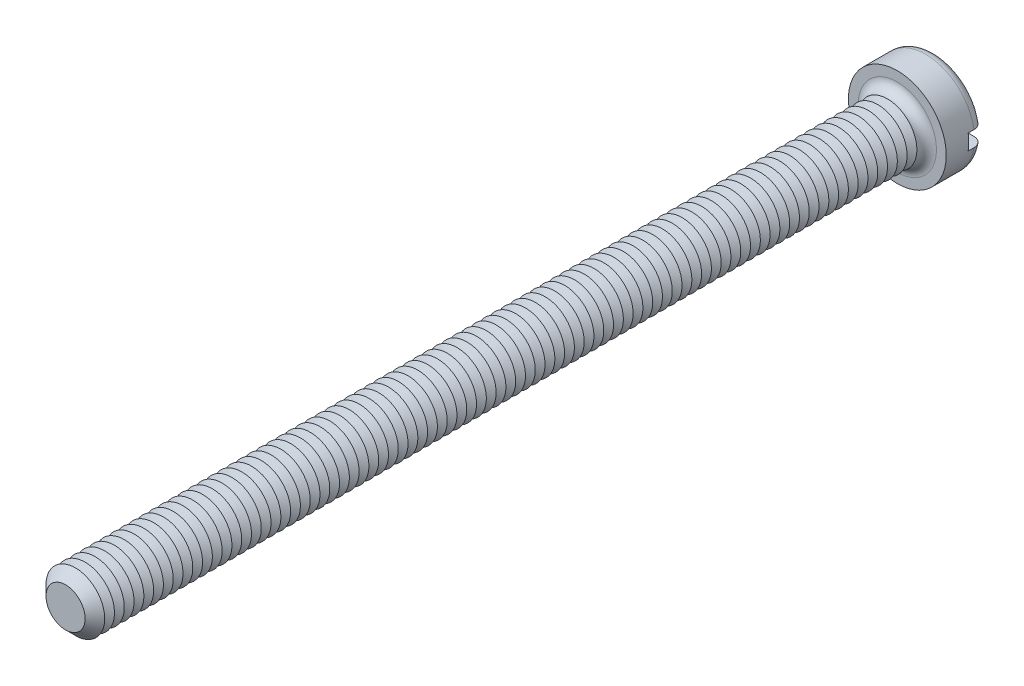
SolidWorks part; units mm, degrees
ref_plane "Front Plane" through (0, 0, 0) normal (0, 0, 1) x (1, 0, 0)
ref_plane "Top Plane" through (0, 0, 0) normal (0, 1, 0) x (1, 0, 0)
ref_plane "Right Plane" through (0, 0, 0) normal (1, 0, 0) x (0, 0, -1)
sketch "Sketch3" plane through (0, 0, 0) normal (0, 0, 1) x (1, 0, 0)
  circle A0 centre (0, 0) radius 5
  dimension "D1" = 10
extrude "Boss-Extrude2" add sketch "Sketch3" against normal blind 3.9
sketch "Sketch4" plane through (0, 0, 0) normal (0, 0, 1) x (1, 0, 0)
  circle A0 centre (0, 0) radius 3
  dimension "D1" = 6
extrude "Boss-Extrude3" add sketch "Sketch4" along normal blind 85
fillet "Fillet1" radius 1 2 edges at (5, 0, -3.9) (3, 0, 0)
chamfer "Chamfer1" distance 1 angle 45 1 edges at (3, 0, 85)
sketch "Sketch5" plane through (0, 0, 0) normal (1, 0, 0) x (0, 0, -1)
  line L0 (1.6944, 0) -> (-7.6738, 0) construction
sketch "Sketch6" plane through (0, 0, 0) normal (1, 0, 0) x (0, 0, -1)
  line L0 (-1, 3) -> (-1.5, 2.134)
  line L1 (-1.5, 2.134) -> (-2, 3)
  line L2 (-1, 3) -> (-84, 3) construction
  line L3 (-2, 3) -> (-1, 3)
  dimension "D1" = 1
revolve "Cut-Revolve1" cut sketch "Sketch6" angle 360 about L0
pattern_linear "LPattern1" count 83 spacing 1 along (0, 0, 1) of "Cut-Revolve1"
sketch "Sketch8" plane through (0, 0, -3.9) normal (0, 0, -1) x (-1, 0, 0)
  line L1 (5, -0.8) -> (-5, -0.8)
  line L2 (5, -0.8) -> (5, 0.8)
  line L3 (5, 0.8) -> (-5, 0.8)
  line L4 (-5, -0.8) -> (-5, 0.8)
  line L5 (5, -0.8) -> (-5, 0.8) construction
  line L6 (5, 0.8) -> (-5, -0.8) construction
  point P0 (0, 0)
  dimension "D1" = 10
  dimension "D2" = 1.6
extrude "Cut-Extrude1" cut sketch "Sketch8" against normal blind 1.6
